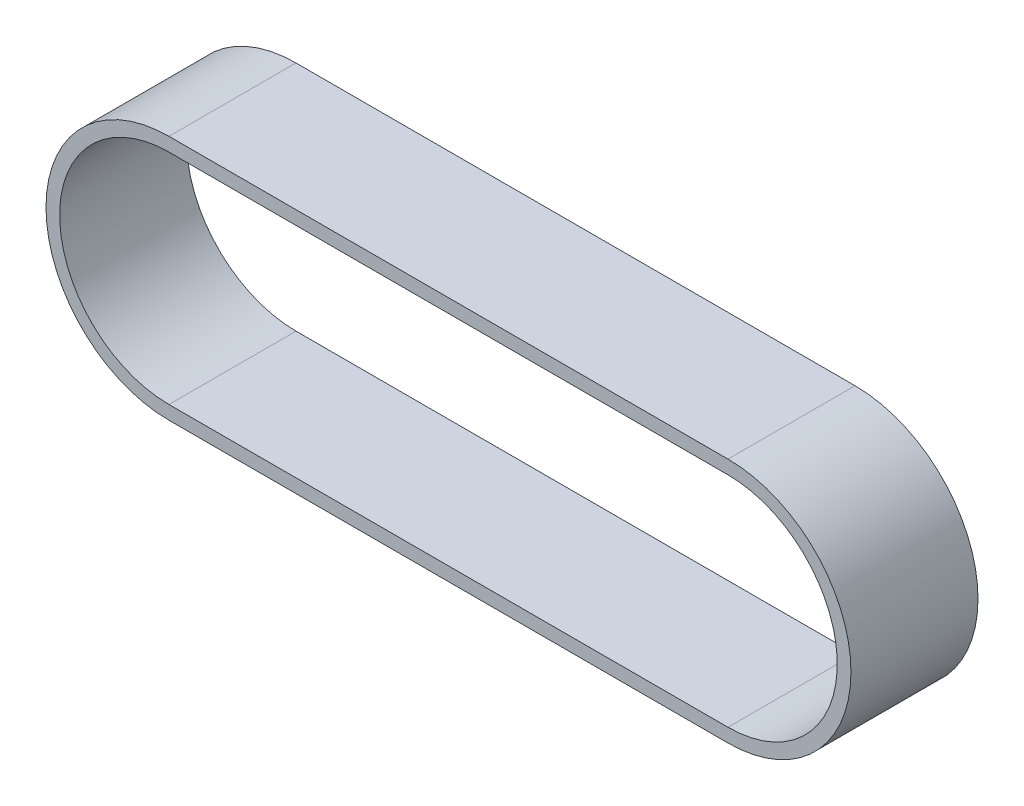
SolidWorks part; units mm, degrees
ref_plane "Front Plane" through (0, 0, 0) normal (0, 0, 1) x (1, 0, 0)
ref_plane "Top Plane" through (0, 0, 0) normal (0, 1, 0) x (1, 0, 0)
ref_plane "Right Plane" through (0, 0, 0) normal (1, 0, 0) x (0, 0, -1)
sketch "Sketch1" plane through (0, 0, 0) normal (0, 0, 1) x (1, 0, 0)
  line L0 (-259.842, 0) -> (259.842, 0) construction
  line L1 (-259.842, 101.6) -> (259.842, 101.6)
  line L2 (-259.842, -101.6) -> (259.842, -101.6)
  line L3 (-259.842, 0) -> (259.842, 0) construction
  line L4 (-259.842, 114.3) -> (259.842, 114.3)
  line L5 (-259.842, -114.3) -> (259.842, -114.3)
  arc A0 (-259.842, 101.6) -> (-259.842, -101.6) centre (-259.842, 0) ccw
  arc A1 (259.842, -101.6) -> (259.842, 101.6) centre (259.842, 0) ccw
  arc A2 (-259.842, 114.3) -> (-259.842, -114.3) centre (-259.842, 0) ccw
  arc A3 (259.842, -114.3) -> (259.842, 114.3) centre (259.842, 0) ccw
  point P2 (0, 0)
  point P10 (0, 0)
  dimension "D1" = 12.7
  dimension "D2" = 203.2
  dimension "6" = 519.684
extrude "Boss-Extrude1" add sketch "Sketch1" along normal blind 118.11
